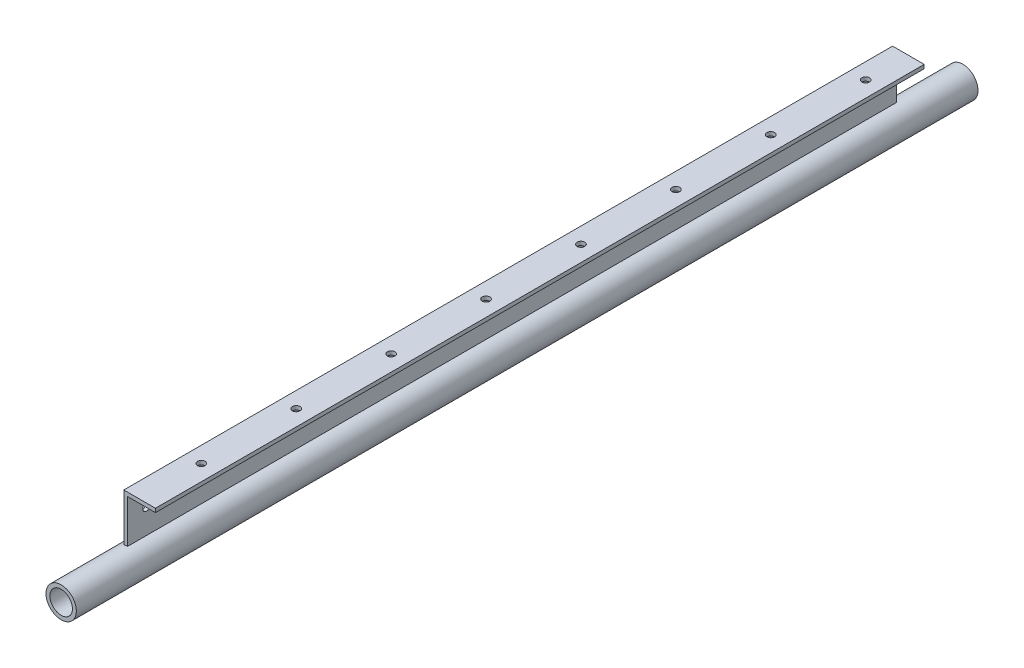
SolidWorks part; units mm, degrees
ref_plane "Face" through (0, 0, 0) normal (0, 0, 1) x (1, 0, 0)
ref_plane "Dessus" through (0, 0, 0) normal (0, 1, 0) x (1, 0, 0)
ref_plane "Droite" through (0, 0, 0) normal (1, 0, 0) x (0, 0, -1)
sketch "Esquisse1" plane through (0, 0, 0) normal (0, 0, 1) x (1, 0, 0)
  line L0 (0, 92.2379) -> (0, 24)
  line L1 (-6, 98.2379) -> (-6, 23.2379)
  line L2 (-6, 98.2379) -> (44, 98.2379)
  line L3 (0, 92.2379) -> (44, 92.2379)
  line L4 (44, 98.2379) -> (44, 92.2379)
  arc A0 (-6, 23.2379) -> (0, 24) centre (0, 0) ccw
  circle A1 centre (0, 0) radius 17.85
  dimension "D1" = 48
  dimension "D2" = 35.7
  dimension "D3" = 6
  dimension "D4" = 75
  dimension "D5" = 50
  dimension "D6" = 6
extrude "Base-Extrusion" add sketch "Esquisse1" along normal blind 1425
sketch "Esquisse2" plane through (0, 0, 1425) normal (0, 0, 1) x (1, 0, 0)
  line L0 (-6, 98.2379) -> (-6, 23.2379)
  line L1 (0, 92.2379) -> (0, 24)
  line L2 (44, 98.2379) -> (44, 92.2379)
  line L3 (-6, 98.2379) -> (44, 98.2379)
  line L4 (0, 92.2379) -> (44, 92.2379)
  line L5 (-6, 98.2379) -> (-6, 23.2379) construction
  line L6 (0, 24) -> (0, 92.2379) construction
  line L7 (0, 92.2379) -> (44, 92.2379) construction
  line L8 (44, 98.2379) -> (-6, 98.2379) construction
  line L9 (44, 92.2379) -> (44, 98.2379) construction
  arc A0 (0, 24) -> (-6, 23.2379) centre (0, 0) ccw
  dimension "D1" = 48
extrude "Enlèv. mat.-Extru.1" cut sketch "Esquisse2" against normal blind 105
sketch "Esquisse3" plane through (0, 0, 0) normal (0, 0, -1) x (-1, 0, 0)
  line L0 (-44, 98.2379) -> (6, 98.2379)
  line L1 (0, 24) -> (0, 92.2379)
  line L2 (0, 92.2379) -> (-44, 92.2379)
  line L3 (-44, 92.2379) -> (-44, 98.2379)
  line L4 (6, 23.2379) -> (6, 98.2379)
  arc A0 (6, 23.2379) -> (0, 24) centre (0, 0) ccw
  dimension "D1" = 48
extrude "Enlèv. mat.-Extru.2" cut sketch "Esquisse3" against normal blind 105
sketch "Esquisse4" plane through (-6, 0, 0) normal (-1, 0, 0) x (0, 0, 1)
  line L0 (1320, 98.2379) -> (1320, 23.2379) construction
  line L1 (1320, 98.2379) -> (105, 98.2379) construction
  circle A0 centre (1290, 63.2379) radius 6
  dimension "D1" = 12
  dimension "D2" = 30
  dimension "D3" = 35
extrude "Enlèv. mat.-Extru.3" cut sketch "Esquisse4" against normal through all
pattern_linear "Répétition linéaire1" count 16 spacing 75 along (0, 0, -1) of "Enlèv. mat.-Extru.3"
sketch "Esquisse5" plane through (0, 98.2379, 0) normal (0, 1, 0) x (-1, 0, 0)
  line L1 (6, 105) -> (-44, 105) construction
  line L3 (6, 1320) -> (6, 105) construction
  circle A0 centre (-19, 172.5) radius 6
  dimension "D1" = 12
  dimension "D2" = 67.5
  dimension "D3" = 25
extrude "Enlèv. mat.-Extru.4" cut sketch "Esquisse5" against normal blind 7
pattern_linear "Répétition linéaire2" count 8 spacing 150 along (0, 0, 1) of "Enlèv. mat.-Extru.4"
